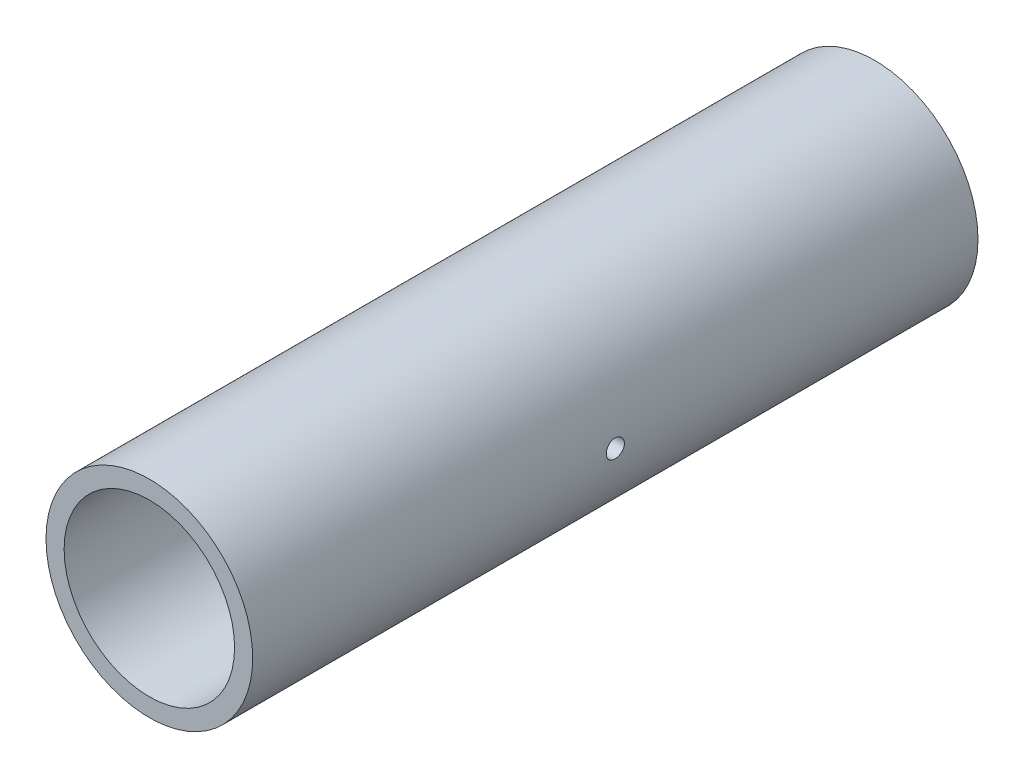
SolidWorks part; units mm, degrees
ref_plane "Front Plane" through (0, 0, 0) normal (0, 0, 1) x (1, 0, 0)
ref_plane "Top Plane" through (0, 0, 0) normal (0, 1, 0) x (1, 0, 0)
ref_plane "Right Plane" through (0, 0, 0) normal (1, 0, 0) x (0, 0, -1)
sketch "Sketch1" plane through (0, 0, 0) normal (0, 0, 1) x (1, 0, 0)
  circle A1 centre (0, 0) radius 28.5
  circle A2 centre (0, 0) radius 23.5
  circle A3 centre (0, 0) radius 23.5
  dimension "D1" = 1
  dimension "D2" = 5
extrude "Boss-Extrude1" add sketch "Sketch1" along normal blind 200
ref_plane "Plane1" through (28.5, 0, 0) normal (1, 0, 0) x (0, 0, -1)
hole_wizard "M6 Tapped Hole1" positions "Sketch2" profile "Sketch3" tap size "M6" standard "DIN"
sketch "Sketch2" plane through (28.5, 0, 0) normal (1, 0, 0) x (0, 0, -1)
  line L0 (31.35, 0) -> (-31.35, 0) construction
  line L1 (-200, 0) -> (0, 0) construction
  line L2 (-200, 28.5) -> (-200, -28.5) construction
  point P0 (-100, 0)
  point P13 (-100, 0)
sketch "Sketch3" plane through (28.5, 0, 100) normal (0, 1, 0) x (0, 0, -1)
  line L0 (0, 0) -> (0, 5)
  line L1 (0, 5) -> (2.5, 5)
  line L2 (2.5, 5) -> (2.5, 0)
  line L5 (2.5, 0) -> (0, 0)
  line L11 (0, -6.35) -> (0, 107.95) construction
  dimension "Thru Tap Drill Dia." = 5
  dimension "Thru Tap Drill Depth" = 5
